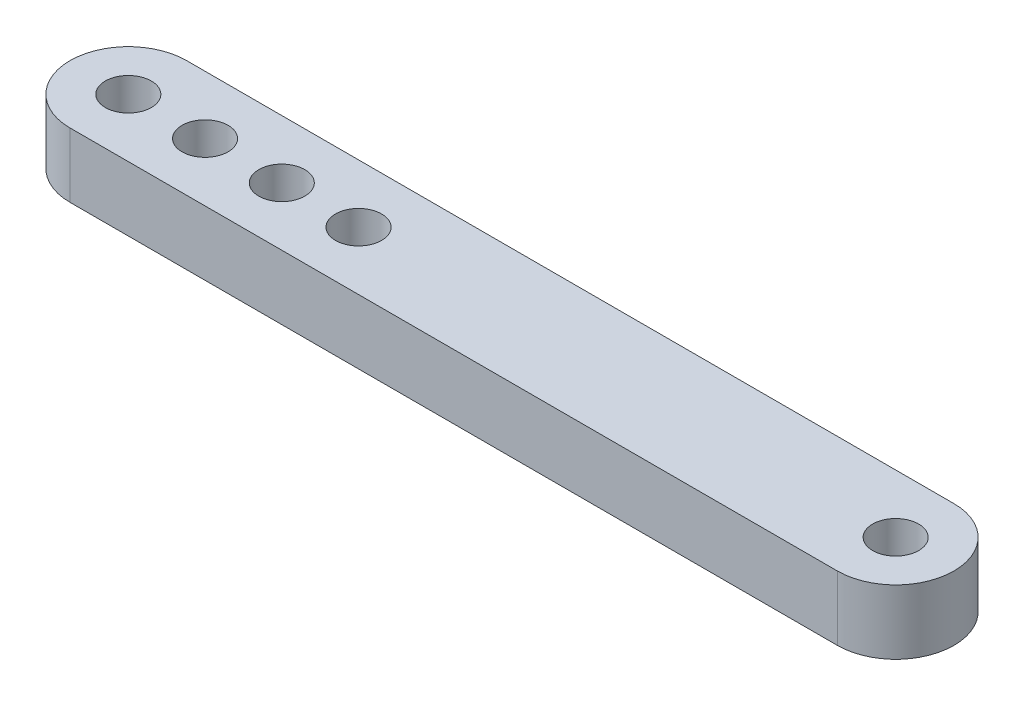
SolidWorks part; units mm, degrees
ref_plane "Front Plane" through (0, 0, 0) normal (0, 0, 1) x (1, 0, 0)
ref_plane "Top Plane" through (0, 0, 0) normal (0, 1, 0) x (1, 0, 0)
ref_plane "Right Plane" through (0, 0, 0) normal (1, 0, 0) x (0, 0, -1)
sketch "Sketch1" plane through (0, 0, 0) normal (0, 1, 0) x (1, 0, 0)
  line L1 (25, -3.8) -> (-25, -3.8)
  line L2 (25, -3.8) -> (25, 3.8)
  line L3 (25, 3.8) -> (-25, 3.8)
  line L4 (-25, -3.8) -> (-25, 3.8)
  line L5 (25, -3.8) -> (-25, 3.8) construction
  line L6 (25, 3.8) -> (-25, -3.8) construction
  circle A0 centre (-25, 0) radius 3.8
  circle A1 centre (25, 0) radius 3.8
  circle A2 centre (-25, 0) radius 1.5
  circle A3 centre (25, 0) radius 1.5
  circle A7 centre (-20, 0) radius 1.5
  circle A8 centre (-15, 0) radius 1.5
  circle A9 centre (-10, 0) radius 1.5
  point P0 (0, 0)
  dimension "D3" = 3
  dimension "D4" = 3
  dimension "D1" = 50
  dimension "D2" = 7.6
  dimension "D5" = 4
extrude "Boss-Extrude1" add sketch "Sketch1" along normal blind 4.2 contours A1 L3 A0 L1 | A2 L4 A0 | A2 L4 A0 | A3 L2 A1 | A3 L2 A1
